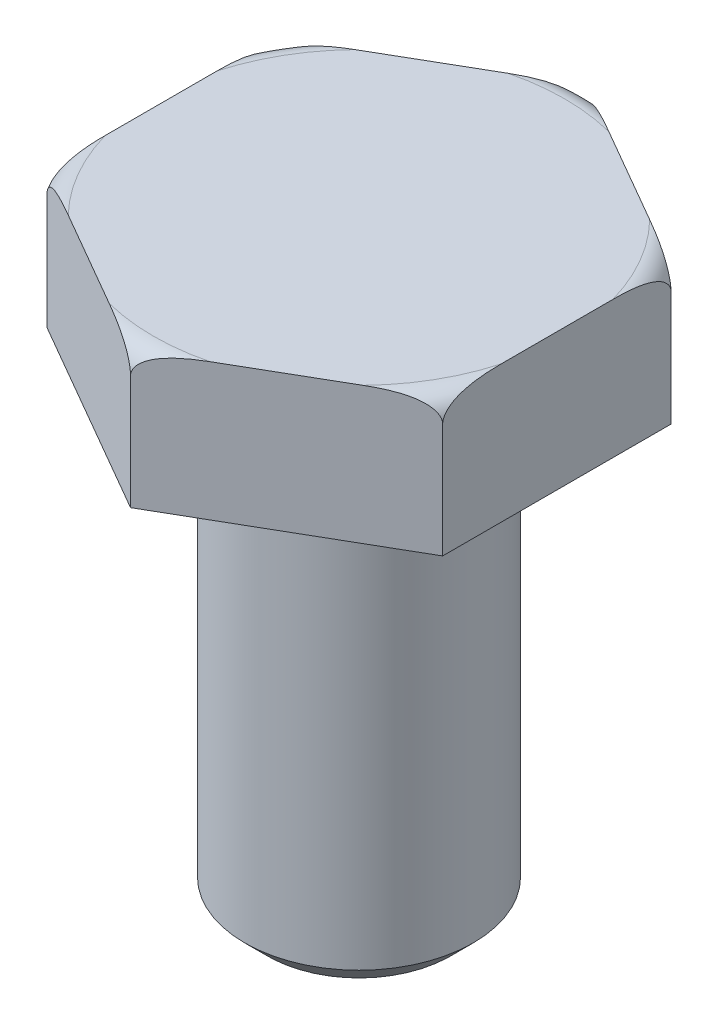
SolidWorks part; units mm, degrees
ref_plane "Plan1" through (0, 0, 0) normal (0, 0, 1) x (1, 0, 0)
ref_plane "Plan2" through (0, 0, 0) normal (0, 1, 0) x (1, 0, 0)
ref_plane "Plan3" through (0, 0, 0) normal (1, 0, 0) x (0, 0, -1)
sketch "Esquisse1" plane through (0, 0, 0) normal (0, 1, 0) x (1, 0, 0)
  circle A0 centre (0, 0) radius 10
extrude "Base-Extrusion" add sketch "Esquisse1" along normal blind 6
fillet "Congé1" radius 1
sketch "Esquisse2" plane through (0, 6, 0) normal (0, 1, 0) x (-1, 0, 0)
  line L0 (0, -10) -> (-8.6613, -4.9983)
  line L1 (-8.6613, -4.9983) -> (-8.6613, 4.9983)
  line L2 (-8.6613, 4.9983) -> (0, 10)
  line L3 (0, 10) -> (8.6613, 4.9983)
  line L4 (8.6613, 4.9983) -> (8.6613, -4.9983)
  line L5 (8.6613, -4.9983) -> (0, -10)
extrude "Enlèv. mat.-Extru.1" cut sketch "Esquisse2" against normal blind 6 flip side to cut
sketch "Esquisse3" plane through (0, 0, 0) normal (0, -1, 0) x (1, 0, 0)
  circle A0 centre (0, 0) radius 5
  dimension "D1" = 10
extrude "Boss.-Extru.1" add sketch "Esquisse3" along normal blind 20
chamfer "Chanfrein5" distance 1 angle 45
